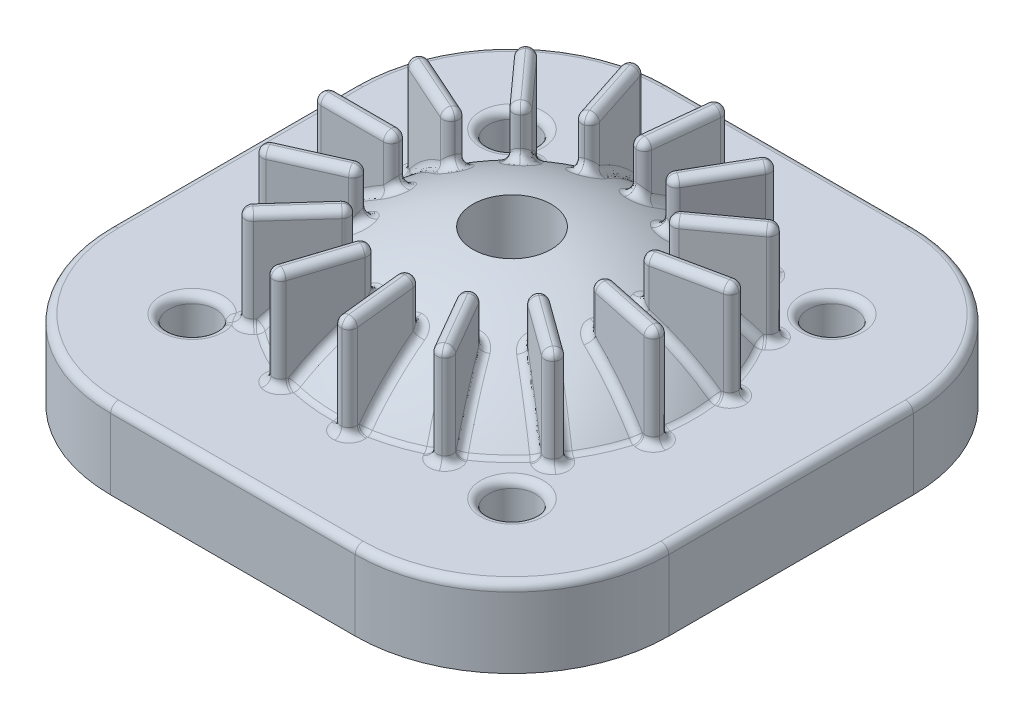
SolidWorks part; units mm, degrees
ref_plane "Front Plane" through (0, 0, 0) normal (0, 0, 1) x (1, 0, 0)
ref_plane "Top Plane" through (0, 0, 0) normal (0, 1, 0) x (1, 0, 0)
ref_plane "Right Plane" through (0, 0, 0) normal (1, 0, 0) x (0, 0, -1)
sketch "Sketch1" plane through (0, 0, 0) normal (0, 1, 0) x (1, 0, 0)
  line L1 (-39, 89) -> (39, 89)
  line L2 (-89, 39) -> (-89, -39)
  line L3 (-39, -89) -> (39, -89)
  line L4 (89, 39) -> (89, -39)
  line L5 (-89, 89) -> (89, -89) construction
  line L6 (-89, -89) -> (89, 89) construction
  arc A0 (-89, -39) -> (-39, -89) centre (-39, -39) ccw
  arc A1 (39, -89) -> (89, -39) centre (39, -39) ccw
  arc A2 (39, 89) -> (89, 39) centre (39, 39) cw
  arc A3 (-39, 89) -> (-89, 39) centre (-39, 39) ccw
  point P0 (0, 0)
  dimension "D3" = 50
  dimension "D1" = 178
  dimension "D2" = 178
extrude "Boss-Extrude1" add sketch "Sketch1" along normal blind 25
sketch "Sketch2" plane through (0, 0, 0) normal (0, -1, 0) x (1, 0, 0)
  line L0 (0, 62.7753) -> (0, 0) construction
  line L1 (0, 0) -> (62.7753, 0) construction
  arc A0 (-61.4676, 26.3191) -> (-61.4676, -26.3191) centre (62.7753, 0) ccw
  arc A1 (-43.6875, 64.0968) -> (-64.0968, 43.6875) centre (-51, 51) ccw
  arc A2 (-43.6875, -64.0968) -> (-64.0968, -43.6875) centre (-51, -51) cw
  arc A3 (37.9627, -58.4181) -> (64.0968, -43.6875) centre (51, -51) ccw
  arc A4 (43.6875, 64.0968) -> (64.0968, 43.6875) centre (51, 51) cw
  arc A5 (-26.3191, -61.4676) -> (37.9627, -58.4181) centre (0, 62.7753) ccw
  arc A6 (-26.3191, 61.4676) -> (26.3191, 61.4676) centre (0, -62.7753) cw
  arc A7 (61.4676, 26.3191) -> (61.4676, -26.3191) centre (-62.7753, 0) cw
  arc A8 (-26.3191, -61.4676) -> (-43.6875, -64.0968) centre (-31.5, -85.9249) ccw
  arc A9 (-61.4676, -26.3191) -> (-64.0968, -43.6875) centre (-85.9249, -31.5) cw
  arc A10 (-61.4676, 26.3191) -> (-64.0968, 43.6875) centre (-85.9249, 31.5) ccw
  arc A11 (-26.3191, 61.4676) -> (-43.6875, 64.0968) centre (-31.5, 85.9249) cw
  arc A12 (26.3191, 61.4676) -> (43.6875, 64.0968) centre (31.5, 85.9249) ccw
  arc A13 (61.4676, 26.3191) -> (64.0968, 43.6875) centre (85.9249, 31.5) cw
  arc A14 (61.4676, -26.3191) -> (64.0968, -43.6875) centre (85.9249, -31.5) ccw
  point P13 (-37.9627, -58.4181)
  point P24 (-58.4181, -37.9627)
  point P27 (-58.4181, 37.9627)
  point P30 (-37.9627, 58.4181)
  point P33 (37.9627, 58.4181)
  point P36 (58.4181, 37.9627)
  point P39 (58.4181, -37.9627)
  dimension "D3" = 25
  dimension "D4" = 15
  dimension "D5" = 127
  dimension "D1" = 102
  dimension "D2" = 102
  dimension "D6" = 63
  dimension "D7" = 63
extrude "Boss-Extrude2" add sketch "Sketch2" along normal blind 6.5
sketch "Sketch3" plane through (0, 0, 0) normal (0, 0, 1) x (1, 0, 0)
  line L0 (0, 0) -> (0, 94.0369) construction
  line L1 (-26.3191, 0) -> (26.3191, 0) construction
  line L2 (0, 50) -> (0, 25)
  line L3 (-39, 25) -> (39, 25) construction
  line L4 (0, 25) -> (57, 25)
  line L5 (89, 25) -> (39, 25) construction
  arc A0 (0, 50) -> (57, 25) centre (0.6503, -25.9972) cw
  dimension "D2" = 76
  dimension "D1" = 25
  dimension "D3" = 114
revolve "Revolve1" add sketch "Sketch3" angle 360 about L0
sketch "Sketch4" plane through (0, 0, 0) normal (0, 0, 1) x (1, 0, 0)
  line L0 (0, -6.5) -> (0, 64.3992) construction
  line L1 (-26.3191, -6.5) -> (26.3191, -6.5) construction
  line L2 (0, 18.5) -> (0, -6.5)
  line L3 (0, -6.5) -> (57, -6.5)
  line L4 (26.3191, -6.5) -> (43.6875, -6.5) construction
  arc A0 (0, 18.5) -> (57, -6.5) centre (0.6503, -57.4972) cw
  dimension "D2" = 76
  dimension "D1" = 114
  dimension "D3" = 25
revolve "Cut-Revolve1" cut sketch "Sketch4" angle 360 about L0
sketch "Sketch5" plane through (0, 25, 0) normal (0, 1, 0) x (1, 0, 0)
  circle A0 centre (-51, -51) radius 7.5
  circle A1 centre (51, -51) radius 7.5
  circle A2 centre (51, 51) radius 7.5
  circle A3 centre (-51, 51) radius 7.5
  circle A4 centre (0, 0) radius 12.5
  dimension "D1" = 15
  dimension "D2" = 25
extrude "Cut-Extrude1" cut sketch "Sketch5" against normal through all both and the other way through all
sketch "Sketch6" plane through (0, 25, 0) normal (0, 1, 0) x (1, 0, 0)
  line L0 (0, 0) -> (-48.5, 0) construction
  line L2 (-61, 2.5) -> (-36, 2.5)
  line L3 (-61, 2.5) -> (-61, -2.5)
  line L4 (-61, -2.5) -> (-36, -2.5)
  line L5 (-36, 2.5) -> (-36, -2.5)
  line L6 (-61, 2.5) -> (-36, -2.5) construction
  line L7 (-61, -2.5) -> (-36, 2.5) construction
  dimension "D1" = 5
  dimension "D2" = 25
  dimension "D3" = 36
extrude "Boss-Extrude3" add sketch "Sketch6" along normal blind 32
pattern_circular "CirPattern1" count 15 over 360 about axis through (0, 0, 0) along (0, 1, 0) of "Boss-Extrude3"
fillet "Fillet1" radius 2.5 88 edges at (40.7068, 57, 26.485) (34.6935, 49.1178, 9.9302) (47.9599, 57, 7.6383) (59.1472, 41, 15.128) (57.1641, 25, 14.7065) (37.7679, 57, 30.5301) (60.1868, 41, 10.2372) (58.2037, 25, 9.8157) (46.2404, 25, 36.6858) (47.9599, 57, -7.6383) (57, 25, 0) (26.4151, 57, 40.7522) (38.1404, 25, 42.3593) (46.9204, 57, -12.5291) (60.1868, 41, -10.2372) (59.1472, 41, -15.128) (15.8349, 49.1178, 32.4269) (57.1641, 25, -14.7065) (27.3212, 25, 52.3217) (40.7068, 57, -26.485) (30.5941, 49.1178, -19.1377) (37.7679, 57, -30.5301) (8.6506, 25, 58.3882) (2.5833, 57, 48.4956) (27.6551, 49.1178, -23.1828) (26.4151, 57, -40.7522) (38.1404, 25, -42.3593) (-12.6097, 57, 46.8988) (-5.9581, 25, 56.6877) (22.0849, 57, -43.2522) (32.6651, 41, -51.5775) (31.6514, 25, -49.8217) (-17.365, 57, 45.3537) (-8.747, 49.1178, 35.0106) (-21.2277, 41, 57.2419) (-13.5023, 49.1178, 33.4655) (27.3212, 25, -52.3217) (-20.6012, 25, 55.3137) (17.614, 25, -54.2102) (-30.595, 57, 37.7154) (6.2493, 49.1178, -35.5415) (-38.9591, 41, 47.0047) (-22.2308, 49.1178, 28.426) (1.2767, 49.1178, -36.0641) (3.8899, 41, -60.9272) (-42.6748, 41, 43.659) (-25.9466, 49.1178, 25.0804) (-12.6097, 57, -46.8988) (-43.2901, 57, 22.0106) (-46.114, 25, 33.5038) (-8.747, 49.1178, -35.0106) (-17.365, 57, -45.3537) (-15.8459, 25, -56.8588) (-52.8573, 25, 26.2702) (-45.3238, 57, 17.4429) (-31.8708, 49.1178, 16.9264) (-13.5023, 49.1178, -33.4655) (-33.9045, 49.1178, 12.3587) (-54.891, 25, 21.7024) (-30.595, 57, -37.7154) (-48.5, 57, 2.5) (-22.2308, 49.1178, -28.426) (-37.6025, 25, -45.498) (-61, 41, 2.5) (-48.5, 57, -2.5) (-25.9466, 49.1178, -25.0804) (-42.6748, 41, -43.659) (-61, 41, -2.5) (-36, 49.1178, -2.5) (-41.3182, 25, -42.1523) (-31.8708, 49.1178, -16.9264) (-54.891, 25, -21.7024) (-54.7094, 41, -27.0948) (-43.2901, 57, -22.0106) (-56.7431, 41, -22.5271) (-45.3238, 57, -17.4429)
fillet "Fillet2" radius 2.5 12 edges at (-74.3553, 25, -74.3553) (0, 25, -89) (74.3553, 25, -74.3553) (89, 25, 0) (74.3553, 25, 74.3553) (0, 25, 89) (-74.3553, 25, 74.3553) (51, 25, -43.5) (51, 25, 58.5) (-51, 25, 58.5) (-51, 25, -43.5) (-89, 25, 0)
